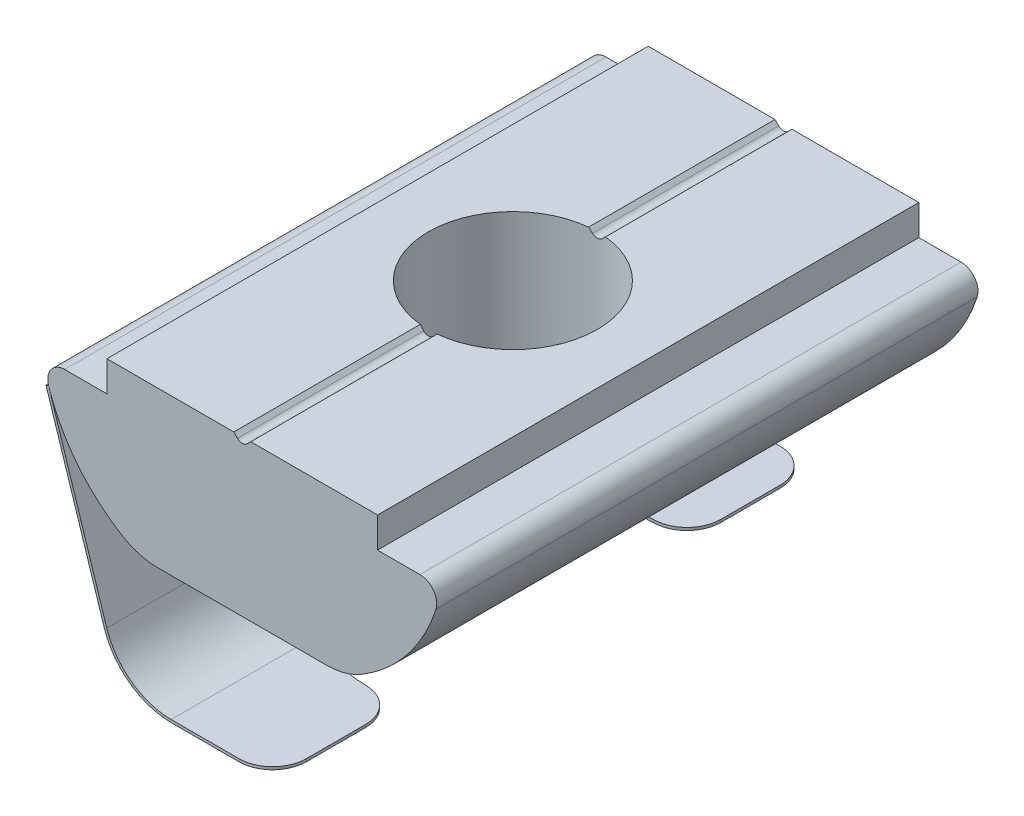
SolidWorks part; units mm, degrees
ref_plane "Front Plane" through (0, 0, 0) normal (0, 0, 1) x (1, 0, 0)
ref_plane "Top Plane" through (0, 0, 0) normal (0, 1, 0) x (1, 0, 0)
ref_plane "Right Plane" through (0, 0, 0) normal (1, 0, 0) x (0, 0, -1)
imported_body "Imported5"
imported_body "Imported6"
sketch "Sketch1" plane through (0, 0, 0) normal (0, 1, 0) x (1, 0, 0)
  circle A0 centre (0, 0) radius 2.5
  dimension "D1" = 5
extrude "M6x1" cut sketch "Sketch1" against normal blind 10
